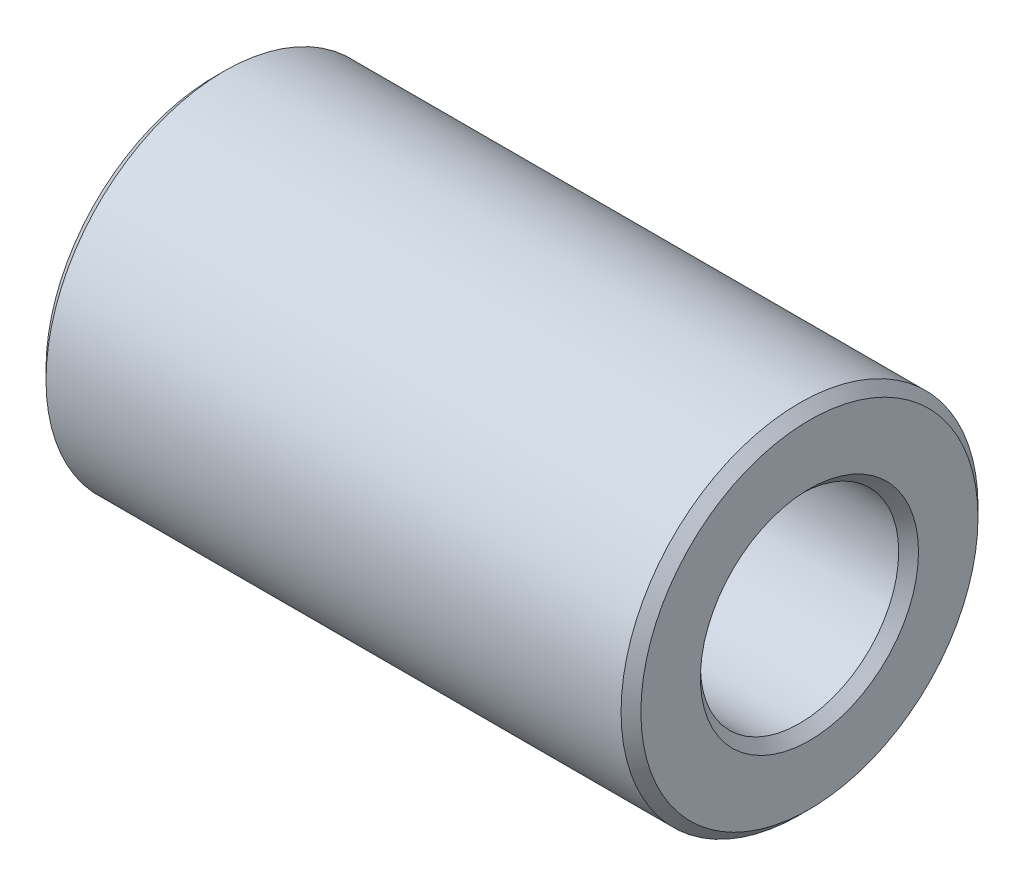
SolidWorks part; units mm, degrees
ref_plane "Plan1" through (0, 0, 0) normal (0, 0, 1) x (1, 0, 0)
ref_plane "Plan2" through (0, 0, 0) normal (0, 1, 0) x (1, 0, 0)
ref_plane "Plan3" through (0, 0, 0) normal (1, 0, 0) x (0, 0, -1)
sketch "Esquisse1" plane through (0, 0, 0) normal (0, 0, 1) x (1, 0, 0)
  line L0 (0, 0) -> (20, 0) construction
  line L1 (-15, 9) -> (15, 9)
  point P5 (0, 9)
  dimension "D1" = 9
  dimension "D2" = 30
revolve "Base-Révol.-Mince" add sketch "Esquisse1" angle 360 about L0
chamfer "Chanfrein1" distance 0.5 angle 45 4 edges at (15, 0, 5) (15, 0, 9) (-15, 0, 9) (-15, 0, 5)
